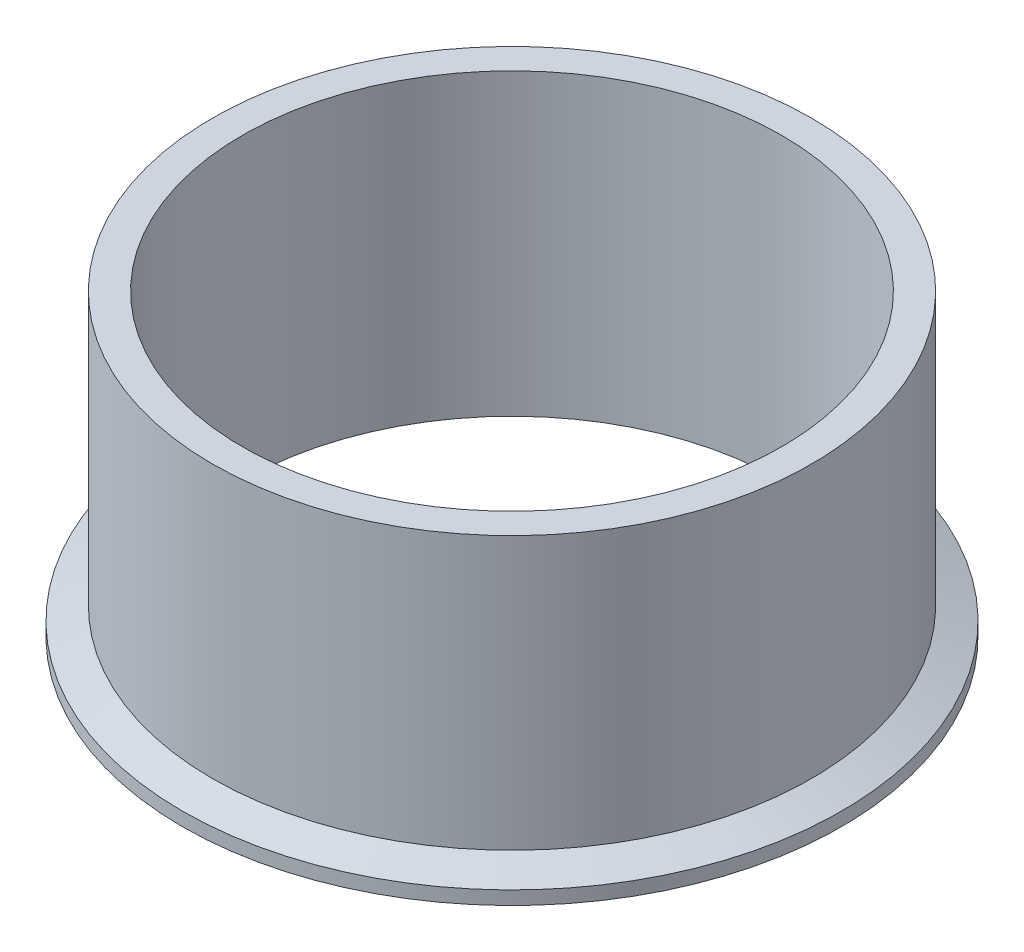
SolidWorks part; units mm, degrees
ref_plane "Front Plane" through (0, 0, 0) normal (0, 0, 1) x (1, 0, 0)
ref_plane "Top Plane" through (0, 0, 0) normal (0, 1, 0) x (1, 0, 0)
ref_plane "Right Plane" through (0, 0, 0) normal (1, 0, 0) x (0, 0, -1)
sketch "Sketch1" plane through (0, 0, 0) normal (0, 0, 1) x (1, 0, 0)
  line L0 (0, 0) -> (0, 53.975) construction
  line L1 (0, 53.975) -> (-54.0512, 53.975)
  line L2 (-54.0512, 53.975) -> (-54.0512, 4.814)
  line L3 (-54.0512, 4.814) -> (-59.4614, 2.4384)
  line L4 (-59.4614, 2.4384) -> (-59.4614, 0)
  line L5 (-59.4614, 0) -> (-56.7743, 0)
  line L6 (-52.8267, 0) -> (0, 0)
  line L7 (0, 0) -> (0, 53.975)
  line L8 (0, 53.975) -> (-48.6664, 53.975)
  line L9 (-48.6664, 53.975) -> (-48.6664, 0)
  line L10 (-48.6664, 0) -> (0, 0)
  line L11 (0, 0) -> (-0.1846, 0.0129)
  line L12 (-55.8994, 0.8729) -> (-56.0728, 0.4643)
  line L15 (-53.7016, 0.8729) -> (-53.5282, 0.4643)
  arc A0 (-53.7016, 0.8729) -> (-55.8994, 0.8729) centre (-54.8005, 0.4064) ccw
  arc A1 (-52.8267, 0) -> (-53.5282, 0.4643) centre (-52.8267, 0.762) cw
  arc A2 (-56.7743, 0) -> (-56.0728, 0.4643) centre (-56.7743, 0.762) ccw
  dimension "D6" = 1.1938
  dimension "D7" = 0.4064
  dimension "D4" = 0.762
  dimension "D1" = 54.0512
  dimension "D3" = 59.4614
  dimension "D5" = 54.8005
  dimension "D8" = 5.3848
  dimension "D9" = 53.975
revolve "Revolve2" add sketch "Sketch1" angle 360 about L0
